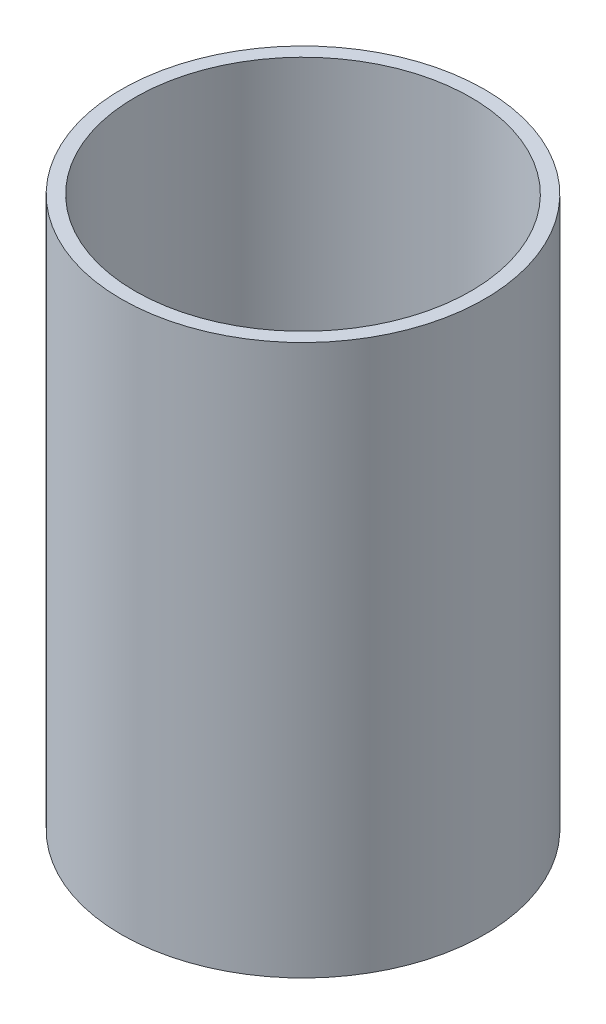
SolidWorks part; units mm, degrees
ref_plane "Front Plane" through (0, 0, 0) normal (0, 0, 1) x (1, 0, 0)
ref_plane "Top Plane" through (0, 0, 0) normal (0, 1, 0) x (1, 0, 0)
ref_plane "Right Plane" through (0, 0, 0) normal (1, 0, 0) x (0, 0, -1)
sketch "Sketch1" plane through (0, 0, 0) normal (0, 1, 0) x (1, 0, 0)
  circle A0 centre (0, 0) radius 33
  circle A1 centre (0, 0) radius 30.5
  dimension "D1" = 66
  dimension "D2" = 2.5
extrude "Boss-Extrude1" add sketch "Sketch1" along normal blind 100
